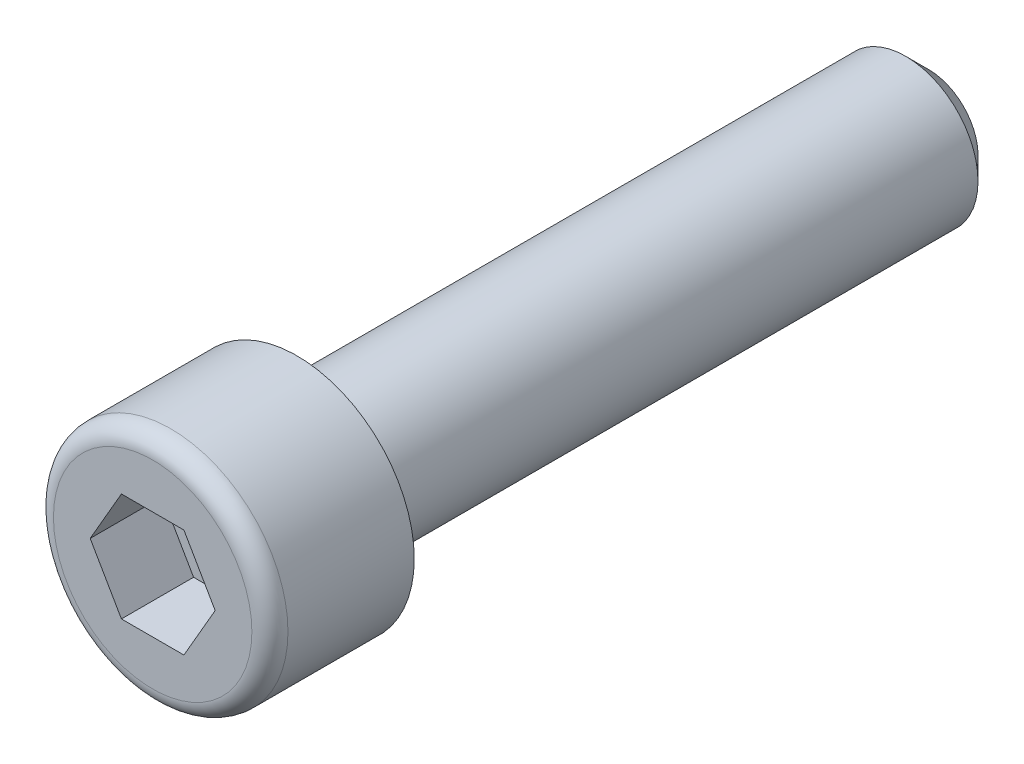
SolidWorks part; units mm, degrees
ref_plane "Plan1" through (0, 0, 0) normal (0, 0, 1) x (1, 0, 0)
ref_plane "Plan2" through (0, 0, 0) normal (0, 1, 0) x (1, 0, 0)
ref_plane "Plan3" through (0, 0, 0) normal (1, 0, 0) x (0, 0, -1)
sketch "Esquisse1" plane through (0, 0, 0) normal (0, 0, 1) x (1, 0, 0)
  circle A0 centre (0, 0) radius 6.5
  dimension "D1" = 13
extrude "Extrusion1" add sketch "Esquisse1" along normal blind 8
fillet "Congé1" radius 1
sketch "Esquisse2" plane through (0, 0, 0) normal (0, 0, -1) x (-1, 0, 0)
  circle A0 centre (0, 0) radius 4
  dimension "D1" = 8
extrude "Extrusion2" add sketch "Esquisse2" along normal blind 35
chamfer "Chanfrein1" distance 1.25 angle 45
sketch "Esquisse3" plane through (0, 0, 8) normal (0, 0, 1) x (1, 0, 0)
  line L1 (3.4641, 0) -> (1.7321, 3)
  line L2 (1.7321, 3) -> (-1.7321, 3)
  line L3 (-1.7321, 3) -> (-3.4641, 0)
  line L4 (-3.4641, 0) -> (-1.7321, -3)
  line L5 (-1.7321, -3) -> (1.7321, -3)
  line L6 (1.7321, -3) -> (3.4641, 0)
  circle A0 centre (0, 0) radius 3 construction
  dimension "D1" = 6
extrude "Enlèv. mat.-Extru.1" cut sketch "Esquisse3" against normal blind 4
